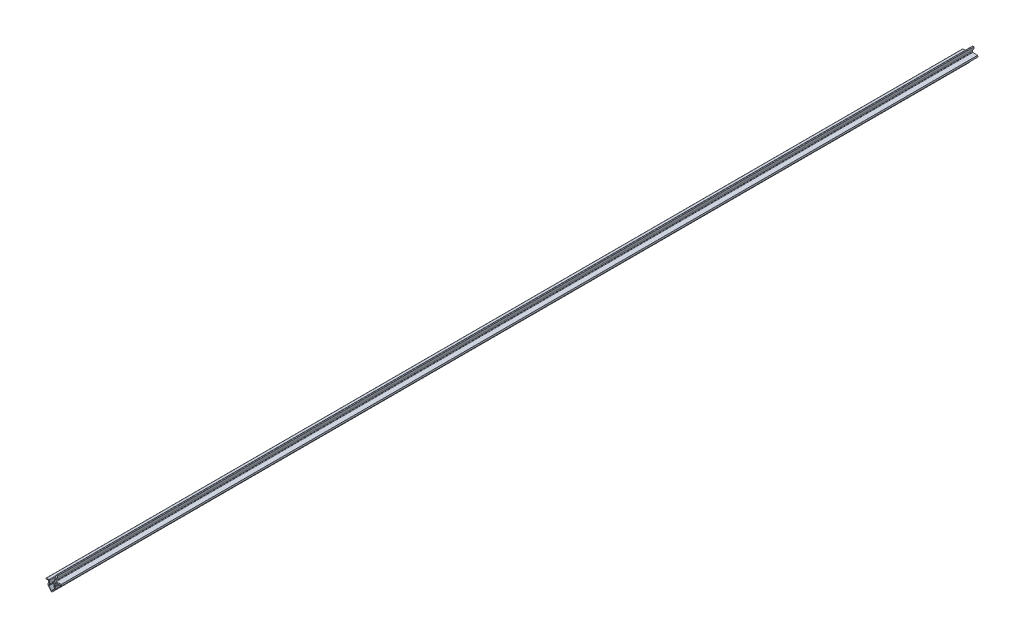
SolidWorks part; units mm, degrees
ref_plane "正面" through (0, 0, 0) normal (0, 0, 1) x (1, 0, 0)
ref_plane "平面" through (0, 0, 0) normal (0, 1, 0) x (1, 0, 0)
ref_plane "右側面" through (0, 0, 0) normal (1, 0, 0) x (0, 0, -1)
sketch "ｽｹｯﾁ2" plane through (0, 0, 0) normal (0, 0, 1) x (1, 0, 0)
  line L0 (-2.1479, 3.6) -> (-1.6232, 3.6)
  line L232 (-8.0683, -11.0717) -> (-10.6183, -7.9619)
  line L233 (-8.6869, -11.579) -> (-11.4183, -8.248)
  line L234 (-10.9317, -3.5) -> (-10.9317, -4.9495)
  line L235 (-13.3817, -2) -> (-10.6317, -2)
  line L236 (-13.8817, -3) -> (-11.4317, -3)
  line L237 (-13.8817, -3) -> (-13.8817, -2.5)
  line L238 (-10.7317, -6.933) -> (-10.7317, -7.6449)
  line L239 (-11.5317, -5.866) -> (-11.5317, -7.931)
  line L240 (-4.6767, -1.0963) -> (-3.4683, 5.1888)
  line L241 (-3.1345, 0.5937) -> (-2.6347, 3.2144)
  line L242 (-7.6817, 1.5812) -> (-7.6817, -12.8282) construction
  line L243 (-4.7451, -7.9619) -> (-7.2951, -11.0717)
  line L244 (-3.9451, -8.248) -> (-6.6764, -11.579)
  line L245 (2.6433, 0) -> (-2.6433, 0)
  line L246 (-1.6817, -1.2) -> (-2.9532, -1.2)
  line L247 (-4.4317, -3.5) -> (-4.4317, -4.9495)
  line L248 (-3.4032, -3) -> (-3.9317, -3)
  line L249 (-3.4032, -1.65) -> (-3.4032, -3)
  line L250 (-10.1317, -2.5) -> (-10.1317, -6.0165)
  line L251 (-5.2317, -1.9018) -> (-5.2317, -6.0165)
  line L252 (-4.6317, -6.933) -> (-4.6317, -7.6449)
  line L253 (-3.8317, -5.866) -> (-3.8317, -7.931)
  line L254 (1.3183, -1.2) -> (0.5183, -2)
  line L255 (-1.6817, -1.2) -> (-1.4817, -2)
  line L256 (0.3183, -1.2) -> (0.5183, -2)
  line L257 (0.3183, -1.2) -> (-0.4817, -2)
  line L258 (-0.6817, -1.2) -> (-1.4817, -2)
  line L259 (-0.6817, -1.2) -> (-0.4817, -2)
  line L260 (2.3183, -1.2) -> (1.5183, -2)
  line L261 (1.3183, -1.2) -> (1.5183, -2)
  line L262 (2.6433, 0) -> (3.0183, -1.5)
  line L263 (3.0183, -1.5) -> (2.5183, -2)
  line L264 (2.3183, -1.2) -> (2.5183, -2)
  line L265 (-2.4863, 6) -> (-1.4233, 6)
  line L268 (-1.4233, 6) -> (-1.6232, 3.6)
  arc A134 (-10.4317, -6.4748) -> (-10.7317, -6.933) centre (-10.2317, -6.933) ccw
  arc A135 (-10.1317, -2.5) -> (-10.6317, -2) centre (-10.6317, -2.5) ccw
  arc A136 (-13.3817, -2) -> (-13.8817, -2.5) centre (-13.3817, -2.5) ccw
  arc A137 (-10.9317, -3.5) -> (-11.4317, -3) centre (-11.4317, -3.5) ccw
  arc A138 (-11.2317, -5.4078) -> (-11.5317, -5.866) centre (-11.0317, -5.866) ccw
  arc A139 (-11.2317, -5.4078) -> (-10.9317, -4.9495) centre (-11.4317, -4.9495) ccw
  arc A140 (-10.7317, -7.6449) -> (-10.6183, -7.9619) centre (-10.2317, -7.6449) ccw
  arc A141 (-11.5317, -7.931) -> (-11.4183, -8.248) centre (-11.0317, -7.931) ccw
  arc A142 (-8.6869, -11.579) -> (-6.6764, -11.579) centre (-7.6817, -10.7547) ccw
  arc A143 (-8.0683, -11.0717) -> (-7.2951, -11.0717) centre (-7.6817, -10.7547) ccw
  arc A144 (-4.9497, -1.4518) -> (-5.2317, -1.9018) centre (-4.7317, -1.9018) ccw
  arc A145 (-3.1345, 0.5937) -> (-2.6433, 0) centre (-2.6433, 0.5) ccw
  arc A146 (-3.9317, -3) -> (-4.4317, -3.5) centre (-3.9317, -3.5) ccw
  arc A147 (-4.9497, -1.4518) -> (-4.6767, -1.0963) centre (-5.1677, -1.0019) ccw
  arc A148 (-2.9532, -1.2) -> (-3.4032, -1.65) centre (-2.9532, -1.65) ccw
  arc A149 (-3.8317, -5.866) -> (-4.1317, -5.4078) centre (-4.3317, -5.866) ccw
  arc A150 (-4.4317, -4.9495) -> (-4.1317, -5.4078) centre (-3.9317, -4.9495) ccw
  arc A151 (-4.7451, -7.9619) -> (-4.6317, -7.6449) centre (-5.1317, -7.6449) ccw
  arc A152 (-3.9451, -8.248) -> (-3.8317, -7.931) centre (-4.3317, -7.931) ccw
  arc A153 (-4.6317, -6.933) -> (-4.9317, -6.4748) centre (-5.1317, -6.933) ccw
  arc A154 (-10.4317, -6.4748) -> (-10.1317, -6.0165) centre (-10.6317, -6.0165) ccw
  arc A155 (-5.2317, -6.0165) -> (-4.9317, -6.4748) centre (-4.7317, -6.0165) ccw
  arc A156 (-2.1479, 3.6) -> (-2.6347, 3.2144) centre (-2.1479, 3.1) ccw
  arc A157 (-2.4863, 6) -> (-3.4683, 5.1888) centre (-2.4863, 5) ccw
extrude "押し出し1" add sketch "ｽｹｯﾁ2" along normal blind 1000
